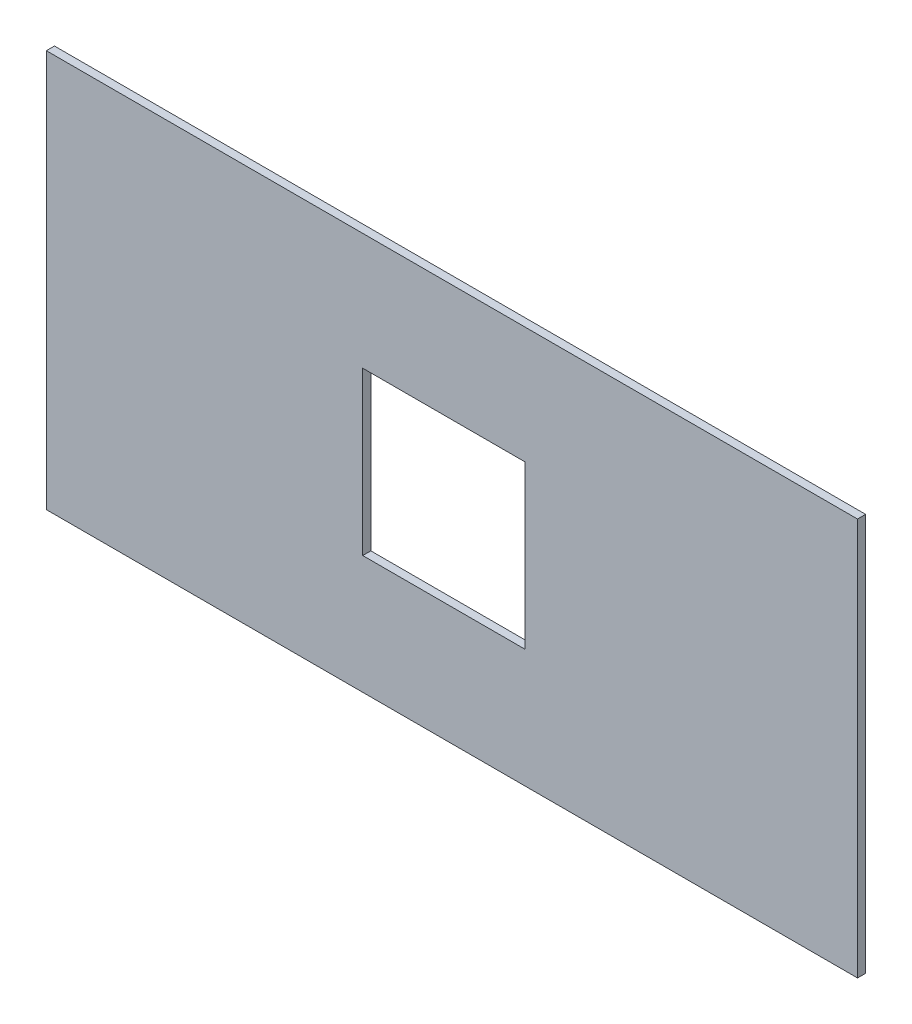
SolidWorks part; units mm, degrees
ref_plane "Front Plane" through (0, 0, 0) normal (0, 0, 1) x (1, 0, 0)
ref_plane "Top Plane" through (0, 0, 0) normal (0, 1, 0) x (1, 0, 0)
ref_plane "Right Plane" through (0, 0, 0) normal (1, 0, 0) x (0, 0, -1)
sketch "Sketch1" plane through (0, 0, 0) normal (0, 0, 1) x (1, 0, 0)
  line L1 (207.0848, -271.4323) -> (334.0848, -271.4323)
  line L2 (207.0848, -271.4323) -> (207.0848, -144.4323)
  line L3 (207.0848, -144.4323) -> (334.0848, -144.4323)
  line L4 (334.0848, -271.4323) -> (334.0848, -144.4323)
  line L5 (594.4348, -364.1594) -> (-40.5652, -364.1594)
  line L6 (594.4348, -364.1594) -> (594.4348, -53.0094)
  line L7 (594.4348, -53.0094) -> (-40.5652, -53.0094)
  line L8 (-40.5652, -364.1594) -> (-40.5652, -53.0094)
  dimension "D3" = 127
  dimension "D1" = 635
  dimension "D2" = 311.15
  dimension "D4" = 127
  dimension "D5" = 247.65
extrude "Boss-Extrude2" add sketch "Sketch1" along normal blind 6.35
